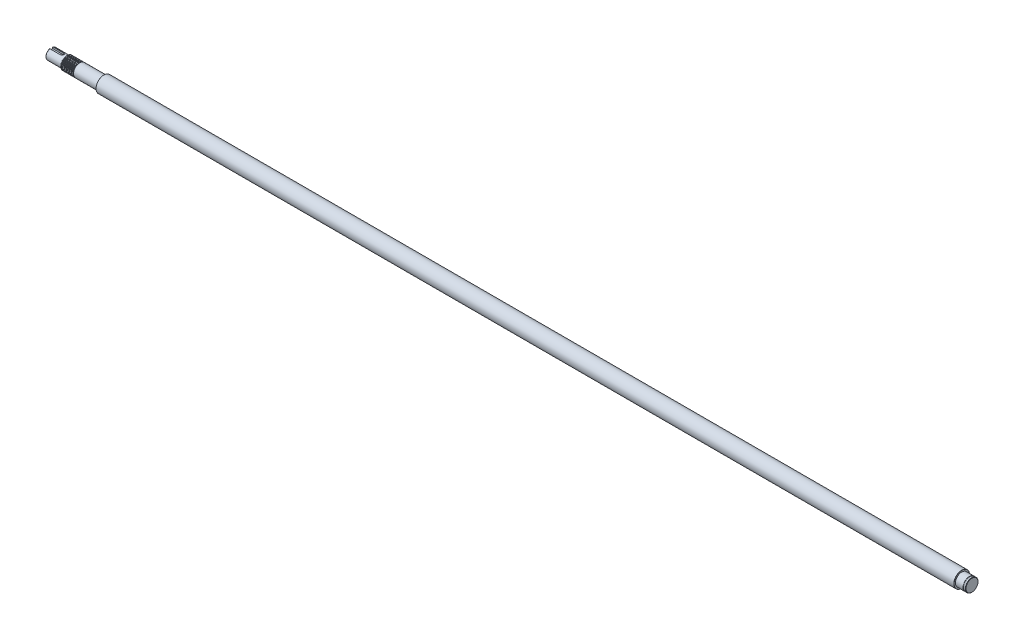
SolidWorks part; units mm, degrees
ref_plane "Front Plane" through (0, 0, 0) normal (0, 0, 1) x (1, 0, 0)
ref_plane "Top Plane" through (0, 0, 0) normal (0, 1, 0) x (1, 0, 0)
ref_plane "Right Plane" through (0, 0, 0) normal (1, 0, 0) x (0, 0, -1)
sketch "Sketch1" plane through (0, 0, 0) normal (0, 0, 1) x (1, 0, 0)
  line L0 (-1396.4663, 0) -> (-1396.4663, 8.5)
  line L1 (-1396.4663, 8.5) -> (-1371.4663, 8.5)
  line L2 (-1371.4663, 8.5) -> (-1371.4663, 10)
  line L3 (-1371.4663, 10) -> (-1313.4663, 10)
  line L4 (-1313.4663, 10) -> (-1313.4663, 12.4)
  line L5 (-1313.4663, 12.4) -> (37.5337, 12.4)
  line L6 (37.5337, 12.4) -> (37.5337, 10)
  line L7 (37.5337, 10) -> (49.5337, 10)
  line L8 (53.5337, 10) -> (53.5337, 0)
  line L9 (53.5337, 0) -> (-1396.4663, 0)
  line L10 (49.5337, 10) -> (49.5337, 9.5)
  line L11 (49.5337, 9.5) -> (50.8837, 9.5)
  line L12 (50.8837, 9.5) -> (50.8837, 10)
  line L13 (50.8837, 10) -> (53.5337, 10)
  point P5 (37.5337, 11.2)
  point P11 (-1371.4663, 9.25)
  point P14 (50.2087, 9.5)
  point P17 (50.8837, 9.75)
  dimension "D1" = 8.5
  dimension "D2" = 10
  dimension "D3" = 12.4
  dimension "D4" = 10
  dimension "D5" = 16
  dimension "D6" = 25
  dimension "D7" = 83
  dimension "D8" = 9.5
  dimension "D9" = 13.35
  dimension "D10" = 1.35
  dimension "D11" = 1351
revolve "Revolve1" add sketch "Sketch1" angle 360 about L9
chamfer "Chamfer1" distance 0.5 angle 45 2 edges at (-1396.4663, 8.5, 0) (53.5337, 10, 0)
chamfer "Chamfer2" distance 0.2 angle 45 3 edges at (37.5337, 12.4, 0) (-1313.4663, 12.4, 0) (-1371.4663, 10, 0)
ref_plane "Plane1" through (0, 8.5, 0) normal (0, 1, 0) x (1, 0, 0)
sketch "Sketch2" plane through (0, 8.5, 0) normal (0, 1, 0) x (1, 0, 0)
  line L0 (-1396.4663, 0) -> (-1378.9663, 0) construction
  line L1 (-1396.4663, 8) -> (-1396.4663, -8) construction
  line L2 (-1396.4663, 2.5) -> (-1378.9663, 2.5)
  line L3 (-1396.4663, -2.5) -> (-1378.9663, -2.5)
  arc A0 (-1396.4663, 2.5) -> (-1396.4663, -2.5) centre (-1396.4663, 0) ccw
  arc A1 (-1378.9663, -2.5) -> (-1378.9663, 2.5) centre (-1378.9663, 0) ccw
  point P5 (-1387.7163, 0)
  dimension "D1" = 5
  dimension "D2" = 17.5
extrude "Cut-Extrude1" cut sketch "Sketch2" against normal blind 3
thread "Thread1" pitch 0.8 start angle 0, offset 0, length 20, pitch 1, diameter 20
ref_plane "Plane2" through (-1371.2663, 0, -10) normal (0, -1, 0) x (0, 0, -1)
sketch "Thread Profile1" plane through (-1371.2663, 0, -10) normal (0, -1, 0) x (0, 0, -1)
  line L0 (0, 0) -> (0, 0.8) construction
  line L11 (0, 0) -> (0, 0.7)
  line L12 (0, 0.7) -> (-0.433, 0.45)
  line L13 (-0.433, 0.45) -> (-0.433, 0.25)
  line L15 (-0.433, 0.25) -> (0, 0)
  line L17 (-0.433, 0.35) -> (0, 0.35) construction
  point P2 (0, 0)
  dimension "Pitch" = 0.8
  dimension "Profile_Angle" = 60
  dimension "Profile_Land" = 0.2
  dimension "Profile_Height" = 0.433
